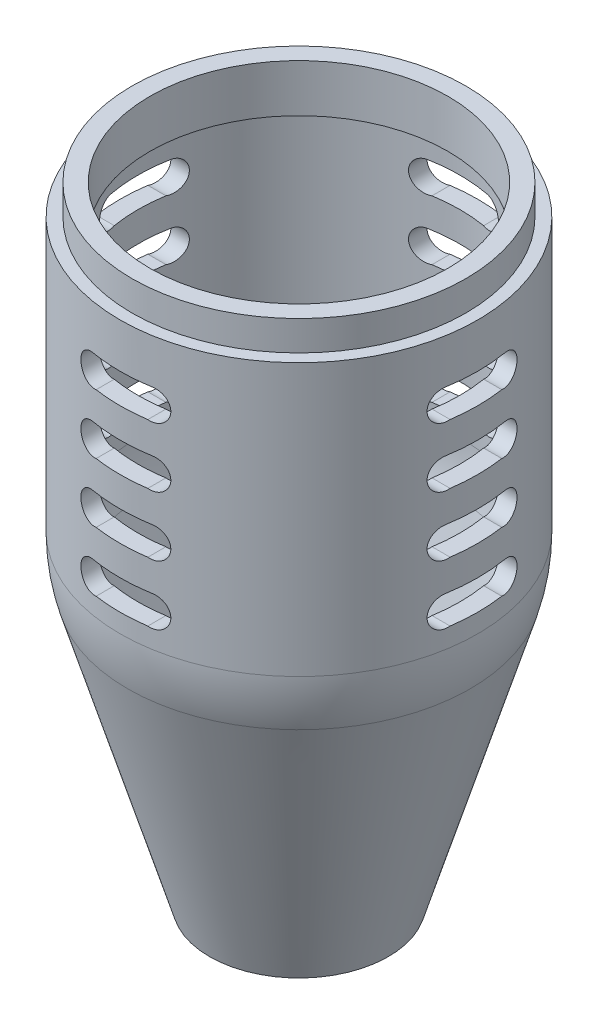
SolidWorks part; units mm, degrees
ref_plane "Front" through (0, 0, 0) normal (0, 0, 1) x (1, 0, 0)
ref_plane "Top" through (0, 0, 0) normal (0, 1, 0) x (1, 0, 0)
ref_plane "Right" through (0, 0, 0) normal (1, 0, 0) x (0, 0, -1)
sketch "Sketch1" plane through (0, 0, 0) normal (0, 0, 1) x (1, 0, 0)
  line L0 (0, 0) -> (0, 100)
  line L1 (0, 100) -> (30, 100)
  line L2 (30, 100) -> (30, 54.4031)
  line L3 (28.7348, 45.7826) -> (15, 0)
  line L4 (15, 0) -> (0, 0)
  line L5 (0, 126.6621) -> (0, -34.8929) construction
  arc A0 (30, 54.4031) -> (28.7348, 45.7826) centre (0, 54.4031) cw
  point P8 (30, 50)
  dimension "D5" = 30
  dimension "D1" = 15
  dimension "D2" = 50
  dimension "D3" = 100
  dimension "D4" = 30
revolve "Revolve1" add sketch "Sketch1" angle 360 about L5
sketch "Sketch2" plane through (0, 100, 0) normal (0, 1, 0) x (-1, 0, 0)
  circle A2 centre (0, 0) radius 28
  circle A3 centre (0, 0) radius 28
  dimension "D1" = 2
extrude "Extrude-Thin1" add sketch "Sketch2" along normal blind 5 thin
shell "Shell2" thickness 3
sketch "Sketch4" plane through (0, 0, 0) normal (0, 0, 1) x (1, 0, 0)
  line L0 (0, -6.9955) -> (0, 111.2685) construction
  line L1 (-5, 62.5446) -> (5, 62.5446)
  line L2 (4.3321, 57.5446) -> (-4.3321, 57.5446)
  line L3 (-15, 0) -> (15, 0) construction
  arc A0 (5, 62.5446) -> (4.3321, 57.5446) centre (5, 60) cw
  arc A1 (-5, 62.5446) -> (-4.3321, 57.5446) centre (-5, 60) ccw
  point P3 (0, 57.5446)
  point P11 (0, 62.5446)
  dimension "D1" = 5
  dimension "D2" = 60
  dimension "D3" = 10
extrude "Cut-Extrude1" cut sketch "Sketch4" against normal through all
pattern_linear "LPattern2" count 4 spacing 10 along (0, 1, 0) of "Cut-Extrude1"
pattern_circular "CirPattern2" count 4 every 90 of "LPattern2", "Cut-Extrude1"
equation "\"D2@CirPattern2\" = 360/\"D1@CirPattern2\""
